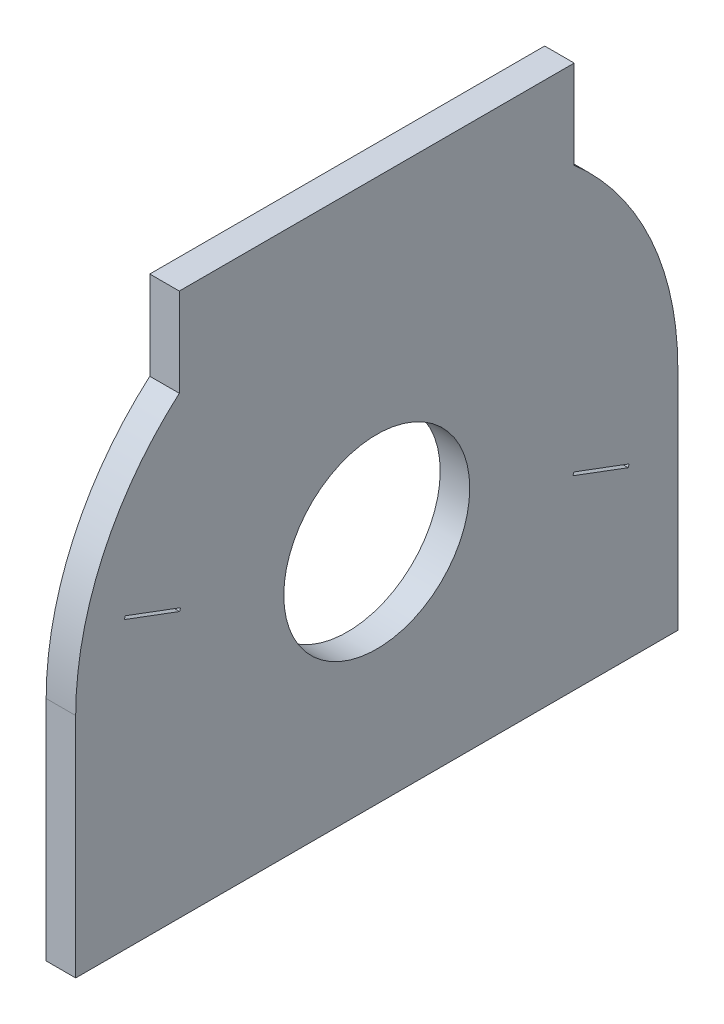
SolidWorks part; units mm, degrees
ref_plane "Front Plane" through (0, 0, 0) normal (0, 0, 1) x (1, 0, 0)
ref_plane "Top Plane" through (0, 0, 0) normal (0, 1, 0) x (1, 0, 0)
ref_plane "Right Plane" through (0, 0, 0) normal (1, 0, 0) x (0, 0, -1)
ref_plane "Plane1" through (-13.55, 0, 0) normal (-1, 0, 0) x (0, -1, 0)
sketch "Sketch1" plane through (-13.55, 0, 0) normal (-1, 0, 0) x (0, -1, 0)
  line L0 (9.513, 8.5192) -> (9.6066, 8.5542)
  line L1 (9.6066, 8.5542) -> (10.307, 6.6808)
  line L2 (10.307, 6.6808) -> (10.2134, 6.6458)
  line L3 (10.2134, 6.6458) -> (9.513, 8.5192)
  line L4 (12.893, -6.6808) -> (12.9866, -6.6458)
  line L5 (12.9866, -6.6458) -> (13.687, -8.5192)
  line L6 (13.687, -8.5192) -> (13.5934, -8.5542)
  line L7 (13.5934, -8.5542) -> (12.893, -6.6808)
  line L8 (11.6, -10.2) -> (19.3, -10.2)
  line L9 (19.3, -10.2) -> (19.3, 10.2)
  line L10 (19.3, 10.2) -> (11.6, 10.2)
  line L11 (3.9, 6.6895) -> (0.9, 6.6895)
  line L12 (0.9, 6.6895) -> (0.9, -6.6895)
  line L13 (0.9, -6.6895) -> (3.9, -6.6895)
  circle A0 centre (11.6, 0) radius 3.15
  arc A1 (3.9, -6.6895) -> (11.6, -10.2) centre (11.6, 0) ccw
  arc A2 (11.6, 10.2) -> (3.9, 6.6895) centre (11.6, 0) ccw
extrude "Boss-Extrude1" add sketch "Sketch1" against normal blind 1
